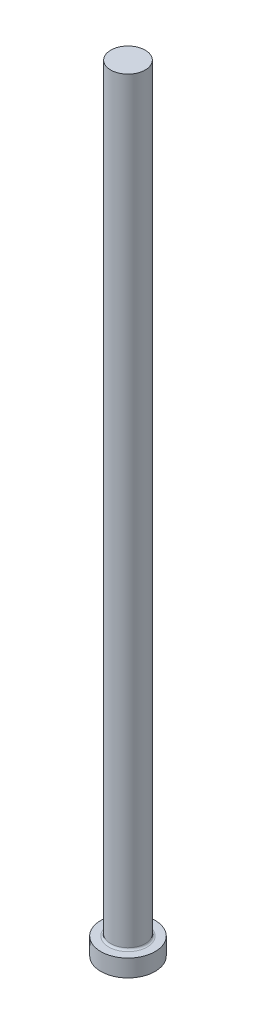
SolidWorks part; units mm, degrees
ref_plane "Plano frontal" through (0, 0, 0) normal (0, 0, 1) x (1, 0, 0)
ref_plane "Plano superior" through (0, 0, 0) normal (0, 1, 0) x (1, 0, 0)
ref_plane "Plano direito" through (0, 0, 0) normal (1, 0, 0) x (0, 0, -1)
sketch "Esboço1" plane through (0, 0, 0) normal (0, 0, 1) x (1, 0, 0)
  line L0 (0, 0) -> (11, 0)
  line L1 (11, 0) -> (11, 7)
  line L2 (11, 7) -> (7.8, 7)
  line L3 (7, 7.8) -> (7, 315)
  line L4 (7, 315) -> (0, 315)
  line L5 (0, 315) -> (0, 0) construction
  line L6 (0, 0) -> (0, 315)
  arc A0 (7.8, 7) -> (7, 7.8) centre (7.8, 7.8) cw
  dimension "D3" = 0.8
  dimension "D1" = 22
  dimension "D2" = 14
  dimension "D4" = 7
  dimension "D5" = 315
revolve "Revolução1" add sketch "Esboço1" angle 360 about L5
sketch "Esboço2"
  dimension "D1" = 0.825
  dimension "D2" = 1.925
  dimension "D3" = 1.2375
  dimension "D4" = 5.9125
wrap "Envolver1" sketch "Esboço2" source sketch "Esboço2" thickness 0.1 parameters "D1"=0.1
